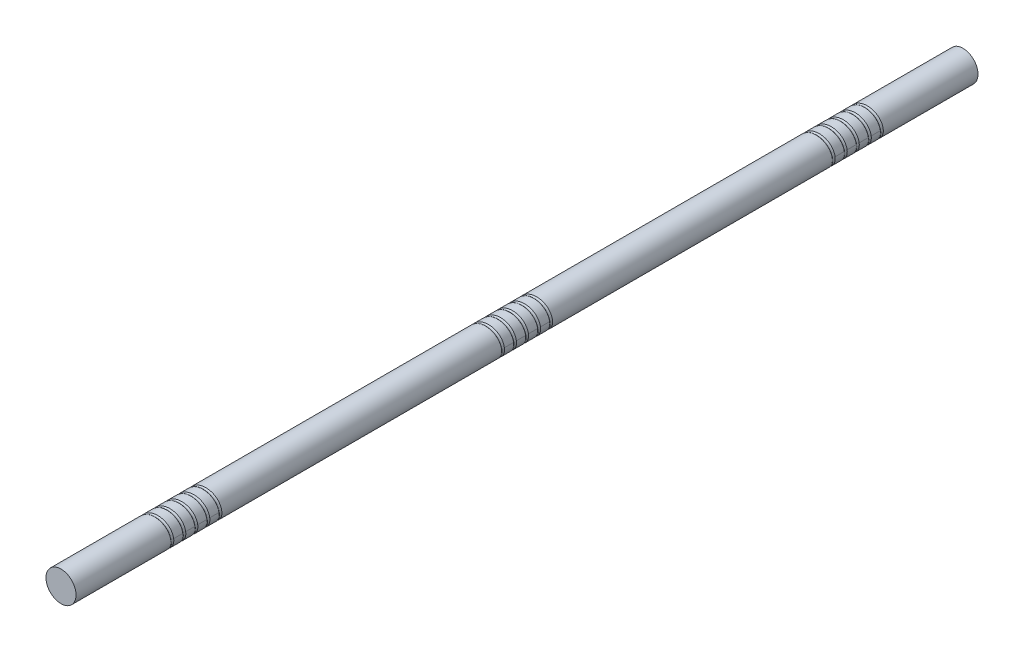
SolidWorks part; units mm, degrees
ref_plane "Front Plane" through (0, 0, 0) normal (0, 0, 1) x (1, 0, 0)
ref_plane "Top Plane" through (0, 0, 0) normal (0, 1, 0) x (1, 0, 0)
ref_plane "Right Plane" through (0, 0, 0) normal (1, 0, 0) x (0, 0, -1)
sketch "Sketch1" plane through (0, 0, 0) normal (0, 0, 1) x (1, 0, 0)
  circle A0 centre (0, 0) radius 25
  dimension "D1" = 50
extrude "Boss-Extrude1" add sketch "Sketch1" along normal blind 1500
ref_plane "Plane1" through (0, 0, 150) normal (0, 0, 1) x (1, 0, 0)
sketch "Sketch2" plane through (0, 0, 150) normal (0, 0, 1) x (1, 0, 0)
  circle A0 centre (0, 0) radius 27.1167
  dimension "D1" = 54.2333
curve "Helix/Spiral1"
sketch "Sketch3" plane through (0, 0, 0) normal (0, 1, 0) x (1, 0, 0)
  circle A0 centre (-27.1167, -150) radius 3.175
  spline S0 degree 3 number of poles 118 (-27.1167, -150) -> (-27.1167, -250) construction
  dimension "D1" = 6.35
sweep "Cut-Sweep1" cut profiles "Sketch3" path "Helix/Spiral1"
pattern_linear "LPattern1" count 3 spacing 550 along (0, 0, -1) of "Cut-Sweep1"
